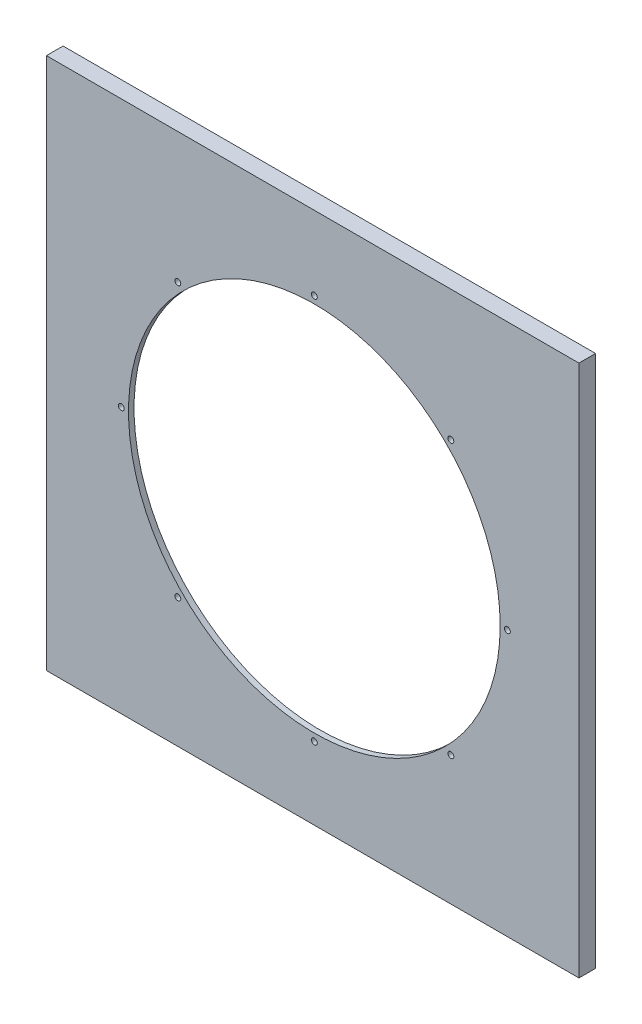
SolidWorks part; units mm, degrees
ref_plane "Front Plane" through (0, 0, 0) normal (0, 0, 1) x (1, 0, 0)
ref_plane "Top Plane" through (0, 0, 0) normal (0, 1, 0) x (1, 0, 0)
ref_plane "Right Plane" through (0, 0, 0) normal (1, 0, 0) x (0, 0, -1)
sketch "Sketch1" plane through (0, 0, 0) normal (0, 0, 1) x (1, 0, 0)
  line L1 (-304.8, 304.8) -> (304.8, 304.8)
  line L2 (-304.8, 304.8) -> (-304.8, -304.8)
  line L3 (-304.8, -304.8) -> (304.8, -304.8)
  line L4 (304.8, 304.8) -> (304.8, -304.8)
  line L5 (-304.8, 304.8) -> (304.8, -304.8) construction
  line L6 (-304.8, -304.8) -> (304.8, 304.8) construction
  point P0 (0, 0)
  dimension "D1" = 609.6
  dimension "D2" = 609.6
extrude "Boss-Extrude1" add sketch "Sketch1" along normal blind 19.05
sketch "Sketch2" plane through (0, 0, 19.05) normal (0, 0, 1) x (1, 0, 0)
  line L0 (1.9091, -0.7637) -> (1.9091, 220.2367) construction
  line L1 (158.18, 155.5072) -> (1.9091, -0.7637) construction
  circle A0 centre (1.9091, -0.7637) radius 212.725 construction
  circle A1 centre (1.9091, -0.7637) radius 266.7 construction
  circle A2 centre (1.9091, -0.7637) radius 221.0003 construction
  circle A3 centre (1.9091, 220.2367) radius 3.3655
  circle A4 centre (158.18, 155.5072) radius 3.3655
  circle A5 centre (222.9094, -0.7637) radius 3.3655
  circle A6 centre (158.18, -157.0345) radius 3.3655
  circle A7 centre (1.9091, -221.764) radius 3.3655
  circle A8 centre (-154.3617, -157.0345) radius 3.3655
  circle A9 centre (-219.0912, -0.7637) radius 3.3655
  circle A10 centre (-154.3617, 155.5072) radius 3.3655
  circle A11 centre (1.9091, -0.7637) radius 212.725
  point P21 (1.9091, -0.7637)
  dimension "D1" = 425.45
  dimension "D2" = 442.0006
  dimension "D3" = 6.731
  dimension "D5" = 425.45
  dimension "D4" = 45
extrude "Cut-Extrude1" cut sketch "Sketch2" against normal through all
sketch "Sketch3" plane through (0, 0, 0) normal (0, 0, -1) x (-1, 0, 0)
  circle A0 centre (0, 0) radius 249.2375
  dimension "D1" = 498.475
extrude "Cut-Extrude2" cut sketch "Sketch3" against normal blind 12.7
